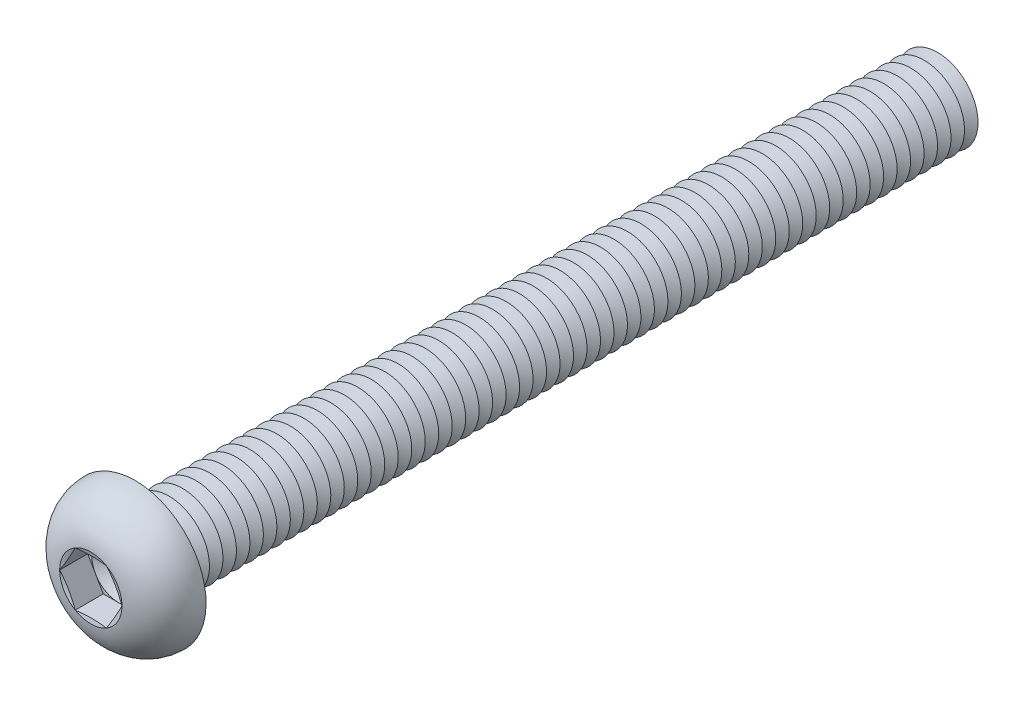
SolidWorks part; units mm, degrees
ref_plane "Front Plane" through (0, 0, 0) normal (0, 0, 1) x (1, 0, 0)
ref_plane "Top Plane" through (0, 0, 0) normal (0, 1, 0) x (1, 0, 0)
ref_plane "Right Plane" through (0, 0, 0) normal (1, 0, 0) x (0, 0, -1)
sketch "Sketch1" plane through (0, 0, 0) normal (1, 0, 0) x (0, 0, -1)
  line L0 (0, 3) -> (0, 5.25)
  line L3 (0, 3) -> (60, 3)
  line L4 (60, 3) -> (60, 0)
  line L5 (60, 0) -> (-3.3, 0) construction
  line L6 (-3.3, 0) -> (60, 0)
  line L7 (-3.3, 2.3094) -> (-3.3, 1.1547) construction
  line L8 (-3.3, 1.1547) -> (-3.3, 0)
  line L9 (-3.3, 2.3094) -> (-2.9906, 1.1547)
  line L10 (-2.9906, 1.1547) -> (-3.3, 1.1547)
  line L11 (60, 0) -> (22.7481, 0) construction
  line L12 (0, 5.25) -> (-3.3, 5.25) construction
  arc A1 (0, 5.25) -> (-3.3, 2.3094) centre (0, 1.928) ccw
  point P8 (60, 1.5)
  dimension "D1" = 10.5
  dimension "D2" = 6
  dimension "D3" = 3.3
  dimension "D4" = 4.6188
  dimension "D5" = 60
  dimension "D6" = 15
revolve "Revolve1" add sketch "Sketch1" angle 360 about L5
fillet "Fillet1" radius 0.5 1 edges at (0, 3, 0)
sketch "Sketch2" plane through (0, 0, 0) normal (1, 0, 0) x (0, 0, -1)
  line L0 (59.5, 3) -> (60.5, 3)
  line L1 (60, 3) -> (0.5, 3) construction
  line L2 (60.5, 3) -> (60, 2.134)
  line L3 (60, -3) -> (60, 3) construction
  line L4 (60, 2.134) -> (59.5, 3)
  dimension "D1" = 1
revolve "Cut-Revolve1" cut sketch "Sketch2" angle 360 about axis through (0, 0, -60) along (0, 0, -1)
pattern_linear "LPattern1" count 60 spacing 1 along (0, 0, 1) of "Cut-Revolve1"
sketch "Sketch3" plane through (0, 0, 3.3) normal (0, 0, 1) x (1, 0, 0)
  line L7 (1.1547, 2) -> (-1.1547, 2)
  line L8 (-1.1547, 2) -> (-2.3094, 0)
  line L9 (-2.3094, 0) -> (-1.1547, -2)
  line L10 (-1.1547, -2) -> (1.1547, -2)
  line L11 (1.1547, -2) -> (2.3094, 0)
  line L12 (2.3094, 0) -> (1.1547, 2)
  circle A0 centre (0, 0) radius 2 construction
  circle A3 centre (0, 0) radius 2.3094 construction
extrude "Cut-Extrude1" cut sketch "Sketch3" against normal blind 2.08
sketch "Sketch4" plane through (0, 0, 1.22) normal (0, 0, 1) x (1, 0, 0)
  line L1 (1.1547, 2) -> (-1.1547, 2) construction
  circle A0 centre (0, 0) radius 2
extrude "Cut-Extrude2" cut sketch "Sketch4" against normal through all draft 60
